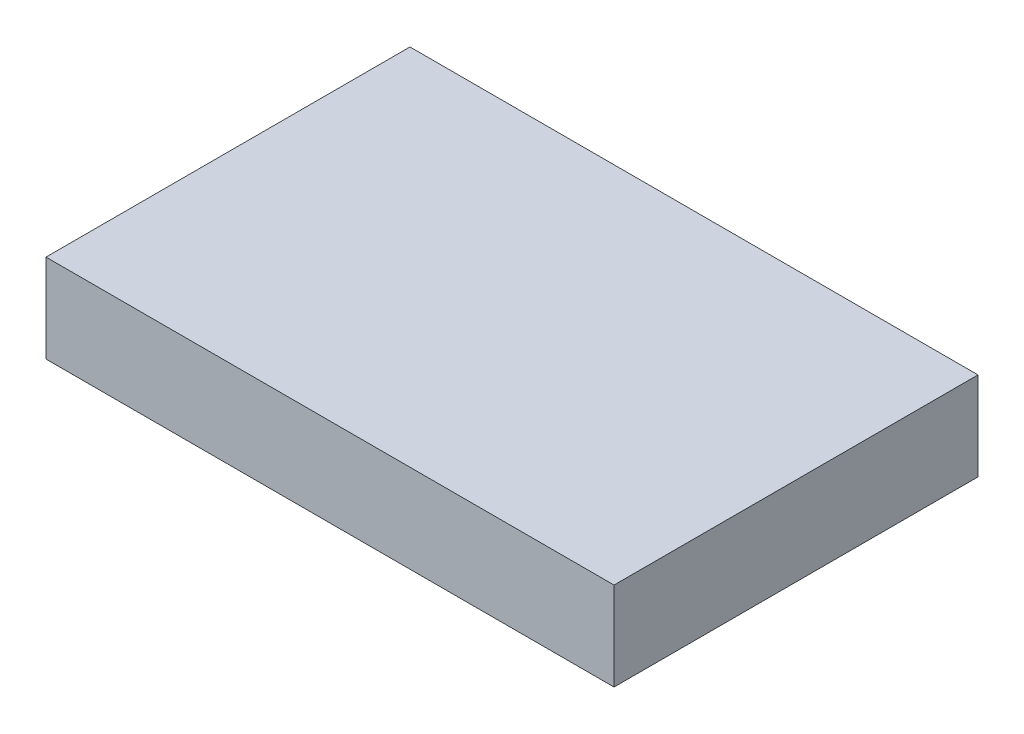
SolidWorks part; units mm, degrees
ref_plane "Front Plane" through (0, 0, 0) normal (0, 0, 1) x (1, 0, 0)
ref_plane "Top Plane" through (0, 0, 0) normal (0, 1, 0) x (1, 0, 0)
ref_plane "Right Plane" through (0, 0, 0) normal (1, 0, 0) x (0, 0, -1)
sketch "Sketch1" plane through (0, 0, 0) normal (0, 1, 0) x (1, 0, 0)
  line L0 (86.7956, -55.6147) -> (-86.7956, 55.6147) construction
  line L1 (-86.7956, 55.6147) -> (86.7956, 55.6147)
  line L2 (-86.7956, 55.6147) -> (-86.7956, -55.6147)
  line L3 (-86.7956, -55.6147) -> (86.7956, -55.6147)
  line L4 (86.7956, 55.6147) -> (86.7956, -55.6147)
extrude "Extrude1" add sketch "Sketch1" along normal blind 27
sketch "Sketch2" plane through (0, 0, 55.6147) normal (0, 0, 1) x (1, 0, 0)
  line L1 (-49.8523, 39.5807) -> (50.1093, 39.5807)
  line L2 (-49.8523, 39.5807) -> (-49.8523, 12.8935)
  line L3 (-49.8523, 12.8935) -> (50.1093, 12.8935)
  line L4 (50.1093, 39.5807) -> (50.1093, 12.8935)
